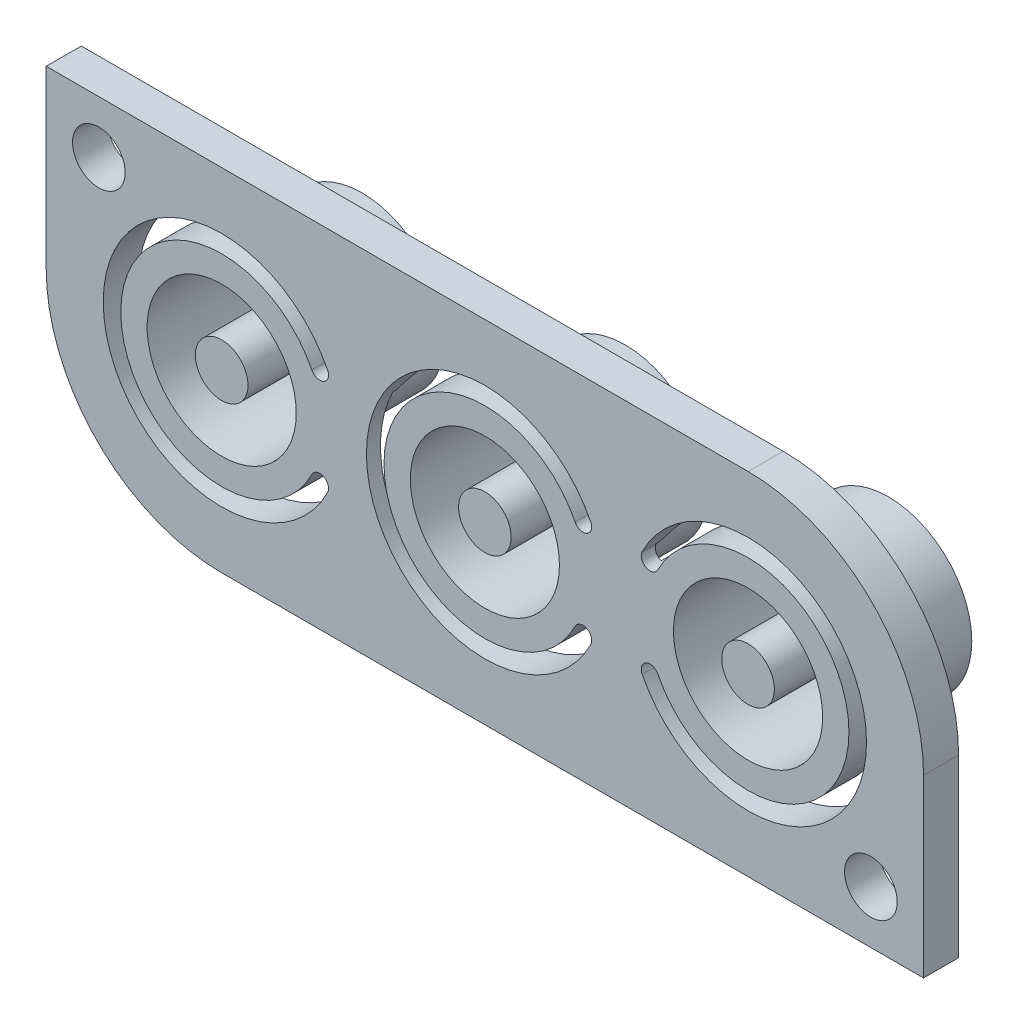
SolidWorks part; units mm, degrees
ref_plane "Alzado" through (0, 0, 0) normal (0, 0, 1) x (1, 0, 0)
ref_plane "Planta" through (0, 0, 0) normal (0, 1, 0) x (1, 0, 0)
ref_plane "Vista lateral" through (0, 0, 0) normal (1, 0, 0) x (0, 0, -1)
sketch "Croquis1" plane through (0, 0, 0) normal (0, 0, 1) x (1, 0, 0)
  line L4 (77.5, 27.5) -> (77.5, 24.2463) construction
  line L5 (52.5, 37.5) -> (102.5, 37.5)
  line L7 (52.5, 17.5) -> (102.5, 17.5)
  line L8 (102.5, 37.5) -> (102.5, 17.5)
  line L10 (52.5, 27.5) -> (102.5, 27.5) construction
  line L11 (52.5, 37.5) -> (52.5, 17.5)
  point P0 (92.5, 27.5)
  dimension "D1" = 20
  dimension "D2" = 50
extrude "Saliente-Extruir1" add sketch "Croquis1" along normal blind 2
sketch "Croquis2" plane through (0, 0, 0) normal (0, 0, -1) x (-1, 0, 0)
  line L0 (-92.5, 27.5) -> (-77.5, 27.5) construction
  circle A4 centre (-92.5, 27.5) radius 4.75
  circle A5 centre (-77.5, 27.5) radius 4.75
  circle A6 centre (-62.5, 27.5) radius 4.75
  dimension "D1" = 9.5
  dimension "D2" = 15
extrude "Saliente-Extruir2" add sketch "Croquis2" along normal blind 6
sketch "Croquis3" plane through (0, 0, 0) normal (0, 0, -1) x (-1, 0, 0)
  line L5 (-86.8264, 25) -> (-68.1736, 30) construction
  line L6 (-86.8264, 30) -> (-68.1736, 25) construction
  line L10 (-85.748, 30) -> (-87.7924, 30.8017) construction
  line L11 (-87.7924, 30.8017) -> (-86.8264, 30) construction
  line L12 (-86.8264, 30) -> (-86.6329, 30.8376) construction
  arc A0 (-87.3586, 30.0746) -> (-86.4645, 30.5224) centre (-86.9115, 30.2985) ccw
  arc A1 (-86.4645, 24.4776) -> (-87.3586, 24.9254) centre (-86.9115, 24.7015) ccw
  arc A2 (-82.6414, 24.9254) -> (-83.5355, 24.4776) centre (-83.0885, 24.7015) ccw
  arc A3 (-83.5355, 30.5224) -> (-82.6414, 30.0746) centre (-83.0885, 30.2985) ccw
  arc A4 (-67.6414, 24.9254) -> (-68.5355, 24.4776) centre (-68.0885, 24.7015) ccw
  arc A5 (-68.5355, 30.5224) -> (-67.6414, 30.0746) centre (-68.0885, 30.2985) ccw
  circle A14 centre (-62.5, 27.5) radius 5.75
  arc A15 (-67.6414, 24.9254) -> (-67.6414, 30.0746) centre (-62.5, 27.5) ccw
  circle A17 centre (-77.5, 27.5) radius 5.75
  arc A18 (-82.6414, 24.9254) -> (-82.6414, 30.0746) centre (-77.5, 27.5) ccw
  arc A19 (-86.4645, 30.5224) -> (-86.4645, 24.4776) centre (-92.5, 27.5) ccw
  circle A20 centre (-92.5, 27.5) radius 5.75
  arc A21 (-87.3586, 30.0746) -> (-87.3586, 24.9254) centre (-92.5, 27.5) ccw
  arc A22 (-83.5355, 24.4776) -> (-83.5355, 30.5224) centre (-77.5, 27.5) ccw
  arc A23 (-68.5355, 24.4776) -> (-68.5355, 30.5224) centre (-62.5, 27.5) ccw
  circle A24 centre (-62.5, 27.5) radius 5.75 construction
  circle A25 centre (-77.5, 27.5) radius 5.75 construction
  circle A26 centre (-62.5, 27.5) radius 6.75 construction
  circle A27 centre (-77.5, 27.5) radius 6.75 construction
  circle A28 centre (-92.5, 27.5) radius 6.75 construction
  circle A29 centre (-92.5, 27.5) radius 5.75 construction
  dimension "D5" = 5
  dimension "D1" = 1
  dimension "D2" = 1
  dimension "D3" = 1
  dimension "D4" = 1
extrude "Cortar-Extruir1" cut sketch "Croquis3" against normal up to surface (2 mm away)
fillet "Redondeo1" radius 10 2 edges at (52.5, 17.5, 1) (102.5, 37.5, 1)
sketch "Croquis6" plane through (0, 0, 2) normal (0, 0, 1) x (1, 0, 0)
  circle A0 centre (62.5, 27.5) radius 4.25
  circle A1 centre (77.5, 27.5) radius 4.25
  circle A2 centre (92.5, 27.5) radius 4.25
  arc A3 (67.6414, 30.0746) -> (67.6414, 24.9254) centre (62.5, 27.5) ccw construction
  dimension "D1" = 1.5
extrude "Cortar-Extruir3" cut sketch "Croquis6" against normal blind 7
sketch "Croquis9" plane through (0, 0, -5) normal (0, 0, 1) x (1, 0, 0)
  circle A0 centre (62.5, 27.5) radius 1.5
  circle A1 centre (77.5, 27.5) radius 1.5
  circle A2 centre (92.5, 27.5) radius 1.5
  dimension "D1" = 3
extrude "Saliente-Extruir3" add sketch "Croquis9" along normal blind 7
sketch "Croquis10" plane through (0, 0, 2) normal (0, 0, 1) x (1, 0, 0)
  line L8 (77.5, 27.5) -> (77.5, 42.4814) construction
  line L9 (77.5, 27.5) -> (69.2679, 27.5) construction
  line L10 (99.5, 20.5) -> (99.5, 17.5) construction
  line L11 (99.5, 20.5) -> (102.5, 20.5) construction
  line L12 (55.5, 34.5) -> (52.5, 34.5) construction
  line L13 (55.5, 34.5) -> (55.5, 37.5) construction
  circle A4 centre (99.5, 20.5) radius 1.5
  circle A5 centre (55.5, 34.5) radius 1.5
extrude "Cortar-Extruir5" cut sketch "Croquis10" against normal up to surface (2 mm away)
sketch "Croquis11" plane through (0, 0, 0) normal (0, 0, -1) x (-1, 0, 0)
  line L0 (-83.5355, 24.4776) -> (-86.4645, 24.4776)
  line L1 (-68.5355, 30.5224) -> (-71.4645, 30.5224)
  line L2 (-83.5355, 30.5224) -> (-86.4645, 30.5224)
  line L3 (-68.5355, 24.4776) -> (-71.4645, 24.4776)
  arc A0 (-68.5355, 24.4776) -> (-68.5355, 30.5224) centre (-62.5, 27.5) ccw
  circle A1 centre (-62.5, 27.5) radius 5.75
  arc A2 (-83.5355, 24.4776) -> (-71.4645, 24.4776) centre (-77.5, 27.5) ccw
  circle A3 centre (-77.5, 27.5) radius 5.75
  arc A4 (-86.4645, 30.5224) -> (-86.4645, 24.4776) centre (-92.5, 27.5) ccw
  circle A5 centre (-92.5, 27.5) radius 6.2
  arc A6 (-71.4645, 30.5224) -> (-83.5355, 30.5224) centre (-77.5, 27.5) ccw
extrude "Cortar-Extruir6" cut sketch "Croquis11" against normal blind 1.2
chamfer "Chaflán1" distance 1 angle 45 4 edges at (85, 30.5224, 0) (70, 30.5224, 0) (70, 24.4776, 0) (85, 24.4776, 0)
sketch "Croquis12" plane through (0, 0, -6) normal (0, 0, -1) x (-1, 0, 0)
  text T0 "<r-45>A</r>" font "HelveticaNeue" height 5
  text T1 "<r-45>B</r>" font "HelveticaNeue" height 5
  text T2 "<r-45>C</r>" font "HelveticaNeue" height 5
extrude "Saliente-Extruir4" add sketch "Croquis12" along normal blind 1
